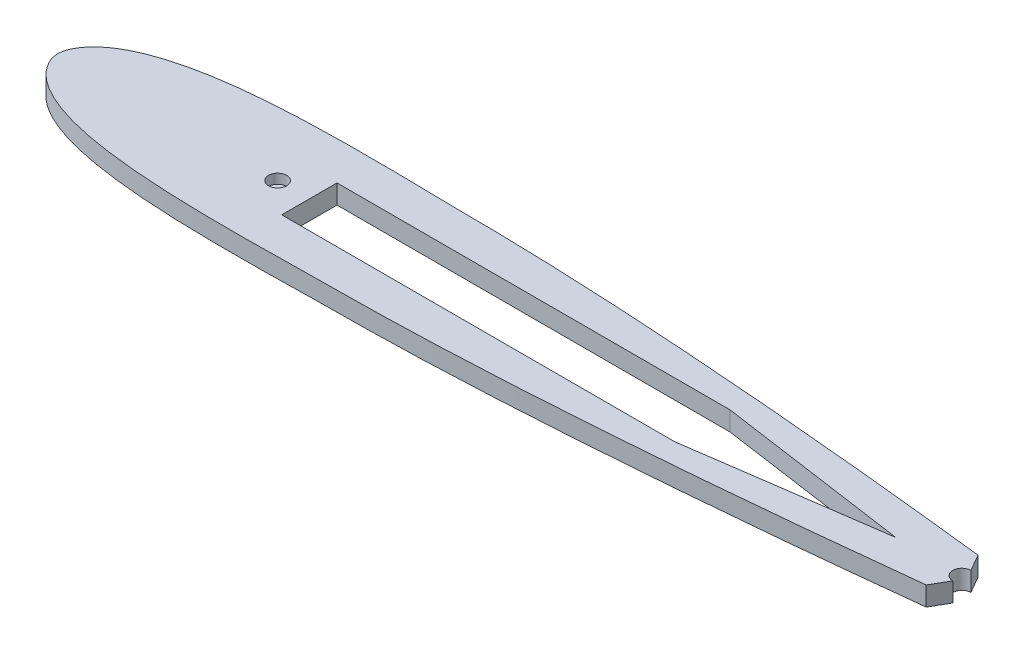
SolidWorks part; units mm, degrees
ref_plane "Front Plane" through (0, 0, 0) normal (0, 0, 1) x (1, 0, 0)
ref_plane "Top Plane" through (0, 0, 0) normal (0, 1, 0) x (1, 0, 0)
ref_plane "Right Plane" through (0, 0, 0) normal (1, 0, 0) x (0, 0, -1)
sketch "Sketch1" plane through (0, 0, 0) normal (0, 1, 0) x (1, 0, 0)
  line L0 (90.9739, 0.0092) -> (90.9982, -0.0058)
  spline S0 degree 3 poles (90.9739, 0.0092) (87.4485, 0.4949) (80.9276, 1.4003) (71.3995, 2.6155) (62.3994, 3.7059) (50.403, 5.0718) (38.4027, 6.3228) (26.3988, 7.4511) (17.3986, 8.225) (8.3988, 8.9279) (-0.6613, 9.5478) (-9.7211, 10.0782) (-18.7819, 10.471) (-27.7825, 10.7612) (-35.225, 10.7561) (-41.1641, 10.8944) (-48.6042, 10.998) (-57.6124, 11.0025) (-66.6197, 10.5269) (-72.3187, 9.8925) (-76.2264, 9.2517) (-79.2289, 8.5684) (-81.6218, 7.845) (-83.4329, 7.183) (-85.2547, 6.353) (-87.1087, 5.2654) (-88.6467, 3.9934) (-90.0012, 2.2908) (-90.9982, 0) (-90.0012, -2.2908) (-88.6467, -3.9934) (-87.1087, -5.2654) (-85.2547, -6.353) (-83.4329, -7.183) (-81.6218, -7.845) (-79.2289, -8.5684) (-76.2264, -9.2517) (-72.3187, -9.8925) (-66.6197, -10.5269) (-57.6124, -11.0025) (-48.6042, -10.998) (-41.1641, -10.8944) (-35.225, -10.7561) (-27.7825, -10.7612) (-18.7819, -10.471) (-9.7211, -10.0782) (-0.6613, -9.5478) (8.3988, -8.9279) (17.3986, -8.225) (26.3988, -7.4511) (38.4027, -6.3228) (50.403, -5.0718) (62.3994, -3.7059) (71.3995, -2.6155) (80.9357, -1.3993) (87.4646, -0.4927) (90.9982, -0.0058) knots -0.004321 -0.004321 -0.004321 -0.004321 0.024634 0.049243 0.07383 0.098397 0.147479 0.171995 0.196494 0.220976 0.245442 0.27038 0.294813 0.319232 0.343642 0.35536 0.367566 0.404183 0.428636 0.44092 0.450818 0.460843 0.465946 0.471149 0.476523 0.482208 0.488618 0.492568 0.5 0.507432 0.511382 0.517792 0.523477 0.528851 0.534054 0.539157 0.549182 0.55908 0.571364 0.595817 0.632434 0.64464 0.656358 0.680768 0.705187 0.72962 0.754558 0.779024 0.803506 0.828005 0.852521 0.901603 0.92617 0.950757 0.975366 1.004387 1.004387 1.004387 1.004387
  point P2 (90.9739, 0.0092)
extrude "Boss-Extrude1" add sketch "Sketch1" along normal blind 3.175
sketch "Sketch2" plane through (0, 3.175, 0) normal (0, 1, 0) x (1, 0, 0)
  line L0 (89.9399, 52.9962) -> (-91.6384, 52.9962) construction
  line L1 (14.9399, 57.4962) -> (46.9272, 52.9962)
  line L2 (-50.0601, 52.9962) -> (-50.0601, 57.4962)
  line L3 (-50.0601, 57.4962) -> (14.9399, 57.4962)
  line L4 (-50.0601, 52.9962) -> (-50.0601, 48.4962)
  line L5 (-50.0601, 48.4962) -> (14.9399, 48.4962)
  line L6 (14.9399, 48.4962) -> (46.9272, 52.9962)
  line L7 (90.9739, 0.0092) -> (-90.6043, 0.0092) construction
  line L8 (16.0439, -4.5628) -> (48.0439, 0.0092)
  line L11 (16.0439, 4.5812) -> (-48.9801, 4.5812)
  line L12 (-48.9801, 0.0092) -> (-48.9801, 4.5812)
  line L15 (16.0439, -4.5628) -> (-48.9801, -4.5628)
  line L16 (-48.9801, 0.0092) -> (-48.9801, -4.5628)
  line L17 (48.0439, 0.0092) -> (16.0439, 4.5812)
  circle A0 centre (58.9739, 0.0092) radius 1.5
  spline S0 degree 3 poles (90.9739, 0.0092) (87.4485, 0.4949) (80.9276, 1.4003) (71.3995, 2.6155) (62.3994, 3.7059) (50.403, 5.0718) (38.4027, 6.3228) (26.3988, 7.4511) (17.3986, 8.225) (8.3988, 8.9279) (-0.6613, 9.5478) (-9.7211, 10.0782) (-18.7819, 10.471) (-27.7825, 10.7612) (-35.225, 10.7561) (-41.1641, 10.8944) (-48.6042, 10.998) (-57.6124, 11.0025) (-66.6197, 10.5269) (-72.3187, 9.8925) (-76.2264, 9.2517) (-79.2289, 8.5684) (-81.6218, 7.845) (-83.4329, 7.183) (-85.2547, 6.353) (-87.1087, 5.2654) (-88.6467, 3.9934) (-90.0012, 2.2908) (-90.9982, 0) (-90.0012, -2.2908) (-88.6467, -3.9934) (-87.1087, -5.2654) (-85.2547, -6.353) (-83.4329, -7.183) (-81.6218, -7.845) (-79.2289, -8.5684) (-76.2264, -9.2517) (-72.3187, -9.8925) (-66.6197, -10.5269) (-57.6124, -11.0025) (-48.6042, -10.998) (-41.1641, -10.8944) (-35.225, -10.7561) (-27.7825, -10.7612) (-18.7819, -10.471) (-9.7211, -10.0782) (-0.6613, -9.5478) (8.3988, -8.9279) (17.3986, -8.225) (26.3988, -7.4511) (38.4027, -6.3228) (50.403, -5.0718) (62.3994, -3.7059) (71.3995, -2.6155) (80.9357, -1.3993) (87.4646, -0.4927) (90.9982, -0.0058) knots -0.004321 -0.004321 -0.004321 -0.004321 0.024634 0.049243 0.07383 0.098397 0.147479 0.171995 0.196494 0.220976 0.245442 0.27038 0.294813 0.319232 0.343642 0.35536 0.367566 0.404183 0.428636 0.44092 0.450818 0.460843 0.465946 0.471149 0.476523 0.482208 0.488618 0.492568 0.5 0.507432 0.511382 0.517792 0.523477 0.528851 0.534054 0.539157 0.549182 0.55908 0.571364 0.595817 0.632434 0.64464 0.656358 0.680768 0.705187 0.72962 0.754558 0.779024 0.803506 0.828005 0.852521 0.901603 0.92617 0.950757 0.975366 1.004387 1.004387 1.004387 1.004387 construction
  point P19 (48.0439, 0.0092)
  dimension "D9" = 3
  dimension "D1" = 65
  dimension "D2" = 4.5
  dimension "D3" = 4.5
  dimension "D4" = 75
  dimension "D5" = 65
  dimension "D6" = 65.024
  dimension "D7" = 4.572
  dimension "D8" = 4.572
  dimension "D10" = 32
extrude "Cut-Extrude1" cut sketch "Sketch2" against normal blind 3.175 contours A0 | L16 L15 L8 L17 L11 L12
sketch "Sketch3" plane through (0, 3.175, 0) normal (0, 1, 0) x (1, 0, 0)
  line L0 (-48.9801, 0.0092) -> (-54.2301, 0.0092) construction
  line L1 (-48.9801, 4.5812) -> (-48.9801, -4.5628) construction
  circle A0 centre (-54.2301, 0.0092) radius 1.5
  dimension "D2" = 3
  dimension "D1" = 5.25
extrude "Cut-Extrude2" cut sketch "Sketch3" against normal blind 1.5875
sketch "Sketch4" plane through (0, 0, 0) normal (0, -1, 0) x (1, 0, 0)
  line L0 (-48.9801, -0.0092) -> (-90.6043, -0.0092) construction
  line L1 (-48.9801, 4.5628) -> (-48.9801, -4.5812) construction
  circle A0 centre (-79.2761, -0.0092) radius 1.5
  circle A1 centre (58.9739, -0.0092) radius 1.5 construction
  spline S0 degree 3 poles (90.9739, -0.0092) (87.4485, -0.4949) (80.9276, -1.4003) (71.3995, -2.6155) (62.3994, -3.7059) (50.403, -5.0718) (38.4027, -6.3228) (26.3988, -7.4511) (17.3986, -8.225) (8.3988, -8.9279) (-0.6613, -9.5478) (-9.7211, -10.0782) (-18.7819, -10.471) (-27.7825, -10.7612) (-35.225, -10.7561) (-41.1641, -10.8944) (-48.6042, -10.998) (-57.6124, -11.0025) (-66.6197, -10.5269) (-72.3187, -9.8925) (-76.2264, -9.2517) (-79.2289, -8.5684) (-81.6218, -7.845) (-83.4329, -7.183) (-85.2547, -6.353) (-87.1087, -5.2654) (-88.6467, -3.9934) (-90.0012, -2.2908) (-90.9982, 0) (-90.0012, 2.2908) (-88.6467, 3.9934) (-87.1087, 5.2654) (-85.2547, 6.353) (-83.4329, 7.183) (-81.6218, 7.845) (-79.2289, 8.5684) (-76.2264, 9.2517) (-72.3187, 9.8925) (-66.6197, 10.5269) (-57.6124, 11.0025) (-48.6042, 10.998) (-41.1641, 10.8944) (-35.225, 10.7561) (-27.7825, 10.7612) (-18.7819, 10.471) (-9.7211, 10.0782) (-0.6613, 9.5478) (8.3988, 8.9279) (17.3986, 8.225) (26.3988, 7.4511) (38.4027, 6.3228) (50.403, 5.0718) (62.3994, 3.7059) (71.3995, 2.6155) (80.9357, 1.3993) (87.4646, 0.4927) (90.9982, 0.0058) knots -0.004321 -0.004321 -0.004321 -0.004321 0.024634 0.049243 0.07383 0.098397 0.147479 0.171995 0.196494 0.220976 0.245442 0.27038 0.294813 0.319232 0.343642 0.35536 0.367566 0.404183 0.428636 0.44092 0.450818 0.460843 0.465946 0.471149 0.476523 0.482208 0.488618 0.492568 0.5 0.507432 0.511382 0.517792 0.523477 0.528851 0.534054 0.539157 0.549182 0.55908 0.571364 0.595817 0.632434 0.64464 0.656358 0.680768 0.705187 0.72962 0.754558 0.779024 0.803506 0.828005 0.852521 0.901603 0.92617 0.950757 0.975366 1.004387 1.004387 1.004387 1.004387 construction
  dimension "D2" = 3
  dimension "D1" = 138.25
extrude "Cut-Extrude3" cut sketch "Sketch4" against normal blind 1.5875
sketch "Sketch5" plane through (0, 3.175, 0) normal (0, 1, 0) x (1, 0, 0)
  line L0 (58.9739, 4.0928) -> (58.9739, 1.5092)
  line L1 (90.9982, -0.0058) -> (90.9739, 0.0092)
  line L2 (90.9982, -0.0058) -> (90.9739, 0.0092)
  line L3 (58.9739, -1.4908) -> (58.9739, -4.0928)
  circle A0 centre (58.9739, 0.0092) radius 1.5 construction
  arc A1 (58.9739, -1.4908) -> (58.9739, 1.5092) centre (58.9739, 0.0092) ccw
  spline S0 degree 3 poles (58.9739, -4.0928) (60.1147, -3.9618) (64.257, -3.4809) (71.3995, -2.6155) (80.9357, -1.3993) (87.4646, -0.4927) (90.9982, -0.0058) knots 0.916828 0.916828 0.916828 0.916828 0.92617 0.950757 0.975366 1.004387 1.004387 1.004387 1.004387
  spline S1 degree 3 poles (1694.9854, 6770.5085) (533.1616, -152.407) (310.0952, -27.8262) (71.3995, 2.6155) (62.3994, 3.7059) (50.403, 5.0718) (38.4027, 6.3228) (26.3988, 7.4511) (17.3986, 8.225) (8.3988, 8.9279) (-0.6613, 9.5478) (-9.7211, 10.0782) (-18.7819, 10.471) (-27.7825, 10.7612) (-35.225, 10.7561) (-41.1641, 10.8944) (-48.6042, 10.998) (-57.6124, 11.0025) (-66.6197, 10.5269) (-72.3187, 9.8925) (-76.2264, 9.2517) (-79.2289, 8.5684) (-81.6218, 7.845) (-83.4329, 7.183) (-85.2547, 6.353) (-87.1087, 5.2654) (-88.6467, 3.9934) (-90.0012, 2.2908) (-90.9982, 0) (-90.0012, -2.2908) (-88.6467, -3.9934) (-87.1087, -5.2654) (-85.2547, -6.353) (-83.4329, -7.183) (-81.6218, -7.845) (-79.2289, -8.5684) (-76.2264, -9.2517) (-72.3187, -9.8925) (-66.6197, -10.5269) (-57.6124, -11.0025) (-48.6042, -10.998) (-41.1641, -10.8944) (-35.225, -10.7561) (-27.7825, -10.7612) (-18.7819, -10.471) (-9.7211, -10.0782) (-0.6613, -9.5478) (8.3988, -8.9279) (17.3986, -8.225) (26.3988, -7.4511) (38.4027, -6.3228) (50.403, -5.0718) (62.3994, -3.7059) (71.3995, -2.6155) (310.0982, 27.8266) (533.1673, 152.4101) (1695.0307, -6770.7785) knots -1.883969 -1.883969 -1.883969 -1.883969 0.024634 0.049243 0.07383 0.098397 0.147479 0.171995 0.196494 0.220976 0.245442 0.27038 0.294813 0.319232 0.343642 0.35536 0.367566 0.404183 0.428636 0.44092 0.450818 0.460843 0.465946 0.471149 0.476523 0.482208 0.488618 0.492568 0.5 0.507432 0.511382 0.517792 0.523477 0.528851 0.534054 0.539157 0.549182 0.55908 0.571364 0.595817 0.632434 0.64464 0.656358 0.680768 0.705187 0.72962 0.754558 0.779024 0.803506 0.828005 0.852521 0.901603 0.92617 0.950757 0.975366 2.883994 2.883994 2.883994 2.883994 only from (90.9739, 0.0092) to (90.9982, -0.0058)
  spline S2 degree 3 poles (90.9739, 0.0092) (87.4485, 0.4949) (80.9276, 1.4003) (71.3995, 2.6155) (64.257, 3.4809) (60.1147, 3.9618) (58.9739, 4.0928) knots -0.004321 -0.004321 -0.004321 -0.004321 0.024634 0.049243 0.07383 0.083172 0.083172 0.083172 0.083172
  dimension "D1" = 0
extrude "Cut-Extrude4" cut sketch "Sketch5" against normal through all both and the other way through all
sketch "Sketch6" plane through (0, 3.175, 0) normal (0, 1, 0) x (1, 0, 0)
  line L0 (58.9739, 1.5092) -> (57.3771, 4.275)
  line L1 (58.9739, -1.4908) -> (57.3657, -4.2763)
  line L2 (58.9739, -4.0927) -> (58.9739, -1.4908)
  line L3 (58.9739, 1.5092) -> (58.9739, 4.0927)
  line L4 (58.9739, -4.0927) -> (58.9739, -1.4908)
  line L5 (58.9739, 1.5092) -> (58.9739, 4.0927)
  arc A1 (58.9739, 1.5092) -> (58.9739, -1.4908) centre (58.9739, 0.0092) ccw
  spline S0 degree 3 poles (57.3657, -4.2763) (57.9018, -4.2155) (58.4379, -4.1542) (58.9739, -4.0927) knots 0.912438 0.912438 0.912438 0.912438 0.916828 0.916828 0.916828 0.916828
  spline S1 degree 3 poles (445.9911, -6807.3844) (1020.6856, -367.4152) (545.8599, -46.579) (38.4031, 6.3227) (26.3995, 7.451) (17.3995, 8.2248) (8.3998, 8.9277) (-0.6601, 9.5476) (-9.7197, 10.078) (-18.7803, 10.4708) (-27.7807, 10.761) (-35.2231, 10.7559) (-41.1621, 10.8942) (-48.6021, 10.9978) (-57.6101, 11.0023) (-66.6172, 10.5267) (-72.3161, 9.8923) (-76.2237, 9.2515) (-79.2261, 8.5683) (-81.619, 7.8448) (-83.4301, 7.1829) (-85.2518, 6.3528) (-87.1058, 5.2653) (-88.6438, 3.9933) (-89.9982, 2.2908) (-90.9952, 0) (-89.9982, -2.2908) (-88.6438, -3.9933) (-87.1058, -5.2652) (-85.2518, -6.3528) (-83.4301, -7.1829) (-81.619, -7.8448) (-79.2261, -8.5682) (-76.2237, -9.2515) (-72.3161, -9.8923) (-66.6172, -10.5267) (-57.6101, -11.0023) (-48.6021, -10.9978) (-41.1621, -10.8942) (-35.2231, -10.7559) (-27.7807, -10.7609) (-18.7803, -10.4708) (-9.7197, -10.078) (-0.6601, -9.5476) (8.3998, -8.9277) (17.3995, -8.2248) (26.3995, -7.451) (38.4031, -6.3227) (545.8516, 46.5781) (1020.67, 367.4046) (446.0203, 6807.0637) knots -3.979188 -3.979188 -3.979188 -3.979188 0.098397 0.147479 0.171995 0.196494 0.220976 0.245442 0.27038 0.294813 0.319232 0.343642 0.35536 0.367566 0.404183 0.428636 0.44092 0.450818 0.460843 0.465946 0.471149 0.476523 0.482208 0.488618 0.492568 0.5 0.507432 0.511382 0.517792 0.523477 0.528851 0.534054 0.539157 0.549182 0.55908 0.571364 0.595817 0.632434 0.64464 0.656358 0.680768 0.705187 0.72962 0.754558 0.779024 0.803506 0.828005 0.852521 0.901603 4.97912 4.97912 4.97912 4.97912 only from (58.9739, 4.0927) to (58.9739, -4.0927)
  spline S2 degree 3 poles (58.9739, 4.0927) (58.4417, 4.1538) (57.9094, 4.2146) (57.3771, 4.275) knots 0.083172 0.083172 0.083172 0.083172 0.087531 0.087531 0.087531 0.087531
  dimension "D2" = 30
  dimension "D3" = 30
  dimension "D1" = 0
extrude "Cut-Extrude5" cut sketch "Sketch6" against normal through all both and the other way through all
